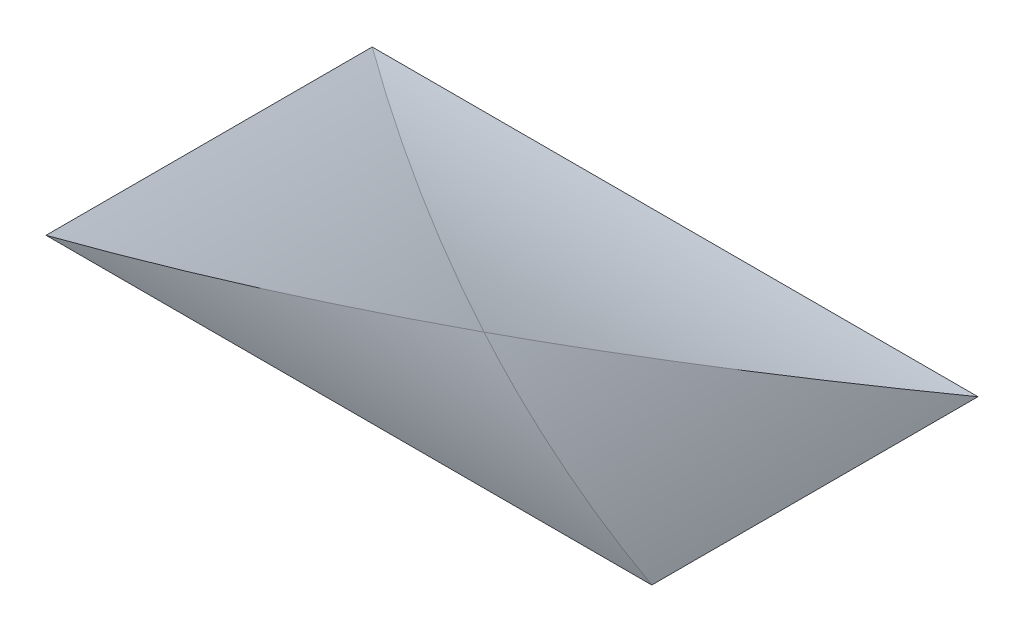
SolidWorks part; units mm, degrees
ref_plane "Ebene vorne" through (0, 0, 0) normal (0, 0, 1) x (1, 0, 0)
ref_plane "Ebene oben" through (0, 0, 0) normal (0, 1, 0) x (1, 0, 0)
ref_plane "Ebene rechts" through (0, 0, 0) normal (1, 0, 0) x (0, 0, -1)
sketch "Skizze1" plane through (0, 0, 0) normal (0, 0, 1) x (1, 0, 0)
  line L0 (0, 0) -> (350, 350)
  line L1 (0, 0) -> (650, 0)
  line L2 (350, 350) -> (1000, 350)
  line L3 (650, 0) -> (1000, 350)
  dimension "D1" = 45
  dimension "D2" = 350
  dimension "D3" = 650
ref_plane "Ebene1" through (0, 0, 30) normal (0, 0, 1) x (1, 0, 0)
sketch "Skizze2" plane through (0, 0, 30) normal (0, 0, 1) x (1, 0, 0)
  line L0 (350, 350) -> (650, 0) construction
  line L1 (0, 0) -> (1000, 350) construction
  point P8 (500, 175)
ref_plane "Ebene2" through (0, 0, 0) normal (-0.3304, 0.9439, 0) x (0, 0, -1)
sketch "Skizze4" plane through (0, 0, 0) normal (-0.3304, 0.9439, 0) x (0, 0, -1)
  line L1 (0, 0) -> (0, -1059.481) construction
  arc A0 (0, 0) -> (0, -1059.481) centre (4662.0833, -529.7405) ccw
ref_plane "Ebene3" through (374.7059, 321.1765, 0) normal (0.7593, 0.6508, 0) x (0, 0, -1)
sketch "Skizze5" plane through (374.7059, 321.1765, 0) normal (0.7593, 0.6508, 0) x (0, 0, -1)
  line L0 (0, -423.0144) -> (0, 37.9628) construction
  arc A0 (0, 37.9628) -> (0, -423.0144) centre (870.4167, -192.5258) ccw
loft "Ausformung1" add profiles "Skizze1", "Skizze2"
